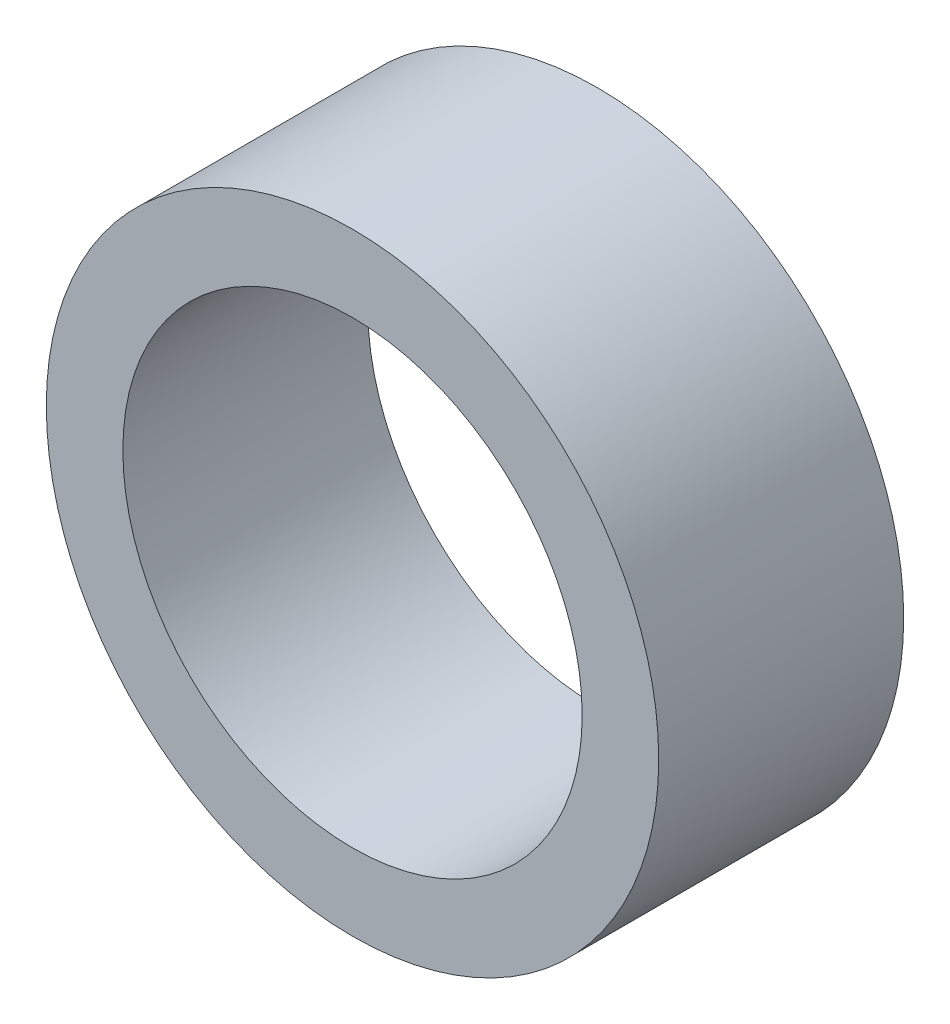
SolidWorks part; units mm, degrees
ref_plane "Front" through (0, 0, 0) normal (0, 0, 1) x (1, 0, 0)
ref_plane "Top" through (0, 0, 0) normal (0, 1, 0) x (1, 0, 0)
ref_plane "Right" through (0, 0, 0) normal (1, 0, 0) x (0, 0, -1)
sketch "Sketch1" plane through (0, 0, 0) normal (0, 0, 1) x (1, 0, 0)
  circle A0 centre (0, 0) radius 2.3813
  circle A1 centre (0, 0) radius 3.175
  dimension "D1" = 4.7625
  dimension "D2" = 6.35
extrude "Extrude1" add sketch "Sketch1" along normal blind 6.35
sketch "Sketch2" plane through (0, 0, 0) normal (0, 0, 1) x (1, 0, 0)
  circle A0 centre (0, 0) radius 3.175
  circle A1 centre (0, 0) radius 3.175 construction
extrude "Cut-Extrude1" cut sketch "Sketch2" along normal blind 3.81
